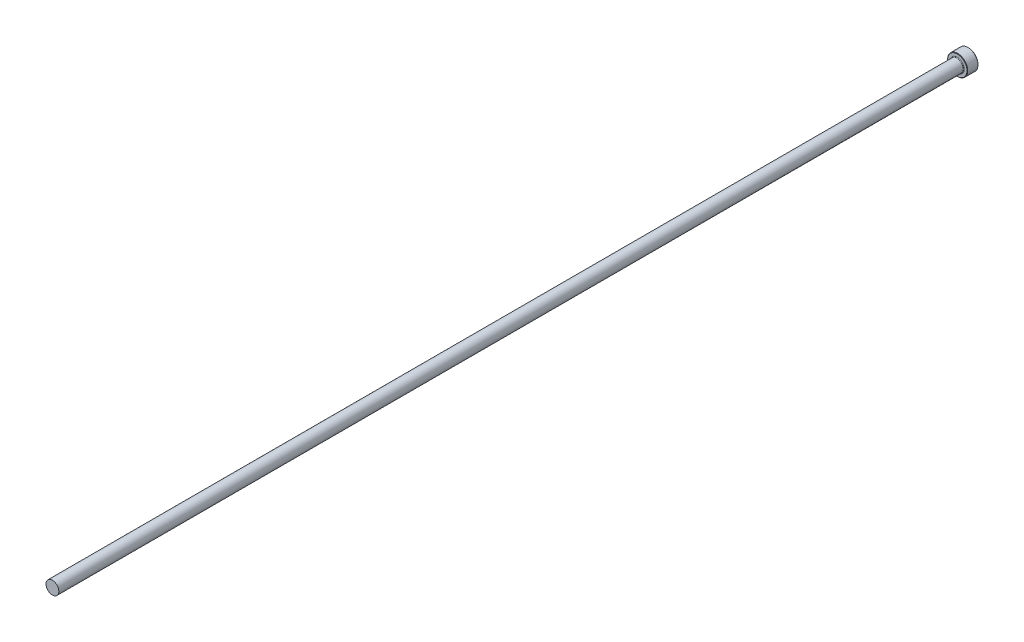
SolidWorks part; units mm, degrees
ref_plane "Front Plane" through (0, 0, 0) normal (0, 0, 1) x (1, 0, 0)
ref_plane "Top Plane" through (0, 0, 0) normal (0, 1, 0) x (1, 0, 0)
ref_plane "Right Plane" through (0, 0, 0) normal (1, 0, 0) x (0, 0, -1)
sketch "Sketch1" plane through (0, 0, 0) normal (1, 0, 0) x (0, 0, -1)
  line L0 (0, 0) -> (0, 5.5)
  line L1 (0, 5.5) -> (0, -5.5) construction
  line L2 (0, 5.5) -> (-6, 5.5)
  line L3 (-6, 5.5) -> (-6, 3.8)
  line L4 (-6.3, 3.5) -> (-500, 3.5)
  line L5 (-500, 3.5) -> (-500, 0)
  line L6 (5.5, 0) -> (-5.5, 0) construction
  line L7 (-500, 0) -> (0, 0)
  line L8 (-109.0506, 0) -> (16.9928, 0) construction
  arc A0 (-6, 3.8) -> (-6.3, 3.5) centre (-6.3, 3.8) cw
  dimension "D1" = 0.3
  dimension "D2" = 11
  dimension "D3" = 7
  dimension "D4" = 500
  dimension "D5" = 6
revolve "Revolve1" add sketch "Sketch1" angle 360 about L8
chamfer "Chamfer1" distance 0.2 angle 45 2 edges at (5.5, 0, 0) (5.5, 0, 6)
